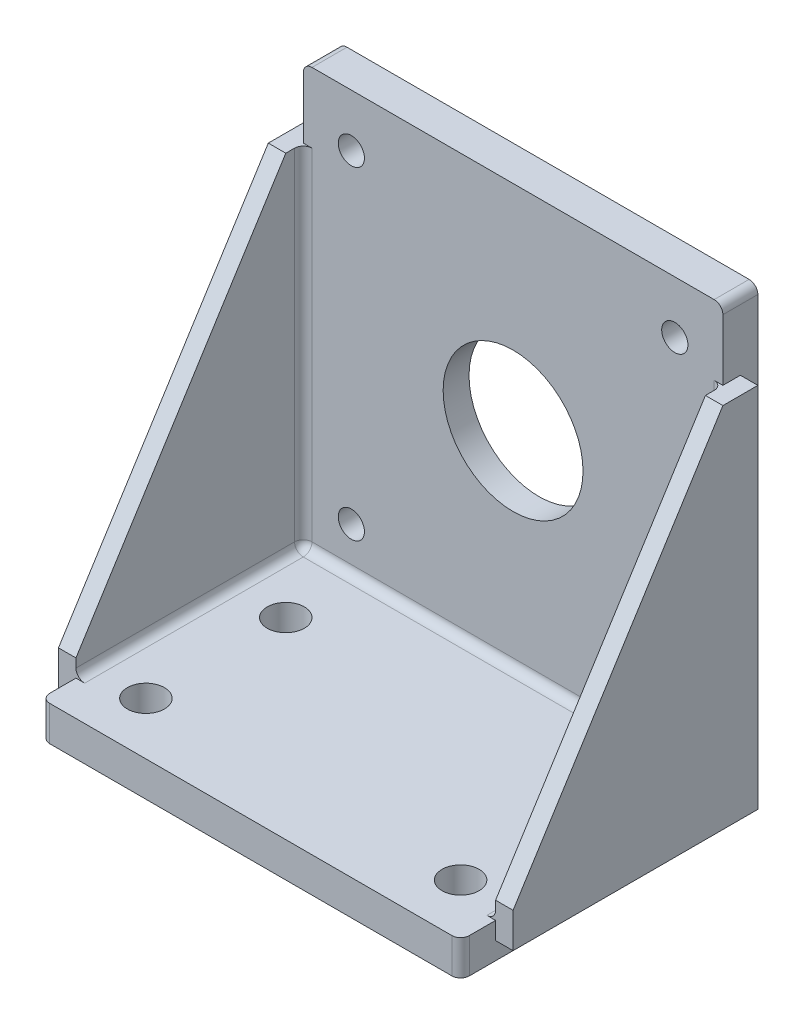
SolidWorks part; units mm, degrees
ref_plane "front" through (0, 0, 0) normal (0, 0, 1) x (1, 0, 0)
ref_plane "top" through (0, 0, 0) normal (0, 1, 0) x (1, 0, 0)
ref_plane "side" through (0, 0, 0) normal (1, 0, 0) x (0, 0, -1)
sketch "Sketch1" plane through (0, 0, 0) normal (0, 0, 1) x (1, 0, 0)
  line L0 (0, 0) -> (0, 77.7875) construction
  line L1 (-58.7375, 0) -> (0, 0) construction
  line L2 (76.2, -74.6125) -> (76.2, 77.7875)
  line L3 (76.2, 77.7875) -> (-76.2, 77.7875)
  line L4 (-76.2, 77.7875) -> (-76.2, -74.6125)
  line L5 (76.2, -74.6125) -> (-76.2, -74.6125)
  line L6 (-58.7375, 58.7375) -> (58.7375, 58.7375) construction
  line L7 (-58.7375, -58.7375) -> (58.7375, -58.7375) construction
  line L8 (-58.7375, -58.7375) -> (-58.7375, 58.7375) construction
  line L9 (58.7375, -58.7375) -> (58.7375, 58.7375) construction
  circle A4 centre (58.7375, 58.7375) radius 4.7625
  circle A6 centre (-58.7375, 58.7375) radius 4.7625
  circle A7 centre (58.7375, -58.7375) radius 4.7625
  circle A8 centre (-58.7375, -58.7375) radius 4.7625
  dimension "D1" = 117.475
  dimension "D3" = 9.525
  dimension "D2" = 152.4
  dimension "D4" = 117.475
  dimension "D5" = 19.05
  dimension "D6" = 152.4
extrude "Base-Extrude" add sketch "Sketch1" along normal blind 12.7
sketch "Sketch2" plane through (76.2, 0, 0) normal (1, 0, 0) x (0, 0, -1)
  line L0 (-6.35, -74.6125) -> (-107.95, -74.6125)
  line L1 (-6.35, -74.6125) -> (-6.35, -87.3125)
  line L2 (-107.95, -87.3125) -> (-6.35, -87.3125)
  line L3 (-107.95, -87.3125) -> (-107.95, -74.6125)
  line L4 (-12.7, -74.6125) -> (0, -74.6125) construction
  dimension "D1" = 101.6
  dimension "D2" = 12.7
extrude "Boss-Extrude1" add sketch "Sketch2" against normal up to vertex (152.4 mm away)
sketch "Sketch3" plane through (76.2, 0, 0) normal (1, 0, 0) x (0, 0, -1)
  line L0 (-6.35, -80.9625) -> (-6.35, 52.3875)
  line L1 (-6.35, 52.3875) -> (-19.05, 52.3875)
  line L2 (-19.05, 52.3875) -> (-95.25, -68.2625)
  line L3 (-95.25, -68.2625) -> (-95.25, -80.9625)
  line L4 (-6.35, -80.9625) -> (-95.25, -80.9625)
  line L5 (-6.35, -74.6125) -> (-6.35, -87.3125) construction
  line L6 (-12.7, 77.7875) -> (0, 77.7875) construction
  line L7 (-107.95, -87.3125) -> (-107.95, -74.6125) construction
  dimension "D1" = 12.7
  dimension "D2" = 12.7
  dimension "D3" = 25.4
  dimension "D4" = 12.7
extrude "Boss-Extrude2" add sketch "Sketch3" along normal blind 6.35
mirror "Mirror1" about plane through (0, 0, 0) normal (1, 0, 0) of "Boss-Extrude2"
sketch "Sketch4" plane through (0, -74.6125, 0) normal (0, 1, 0) x (-1, 0, 0)
  line L0 (76.2, 95.25) -> (76.2, 107.95) construction
  line L1 (76.2, 107.95) -> (-76.2, 107.95) construction
  circle A0 centre (57.15, 88.9) radius 6.7437
  dimension "D1" = 13.4874
  dimension "D2" = 19.05
  dimension "D3" = 19.05
extrude "Cut-Extrude1" cut sketch "Sketch4" against normal through all
pattern_linear "LPattern1" count 2 spacing 114.3 along (1, 0, 0) count 2 spacing 50.8 along (0, 0, -1) of "Cut-Extrude1"
sketch "Sketch5" plane through (0, 0, 0) normal (0, 0, -1) x (-1, 0, 0)
  circle A0 centre (0, 0) radius 63.5635
  dimension "D1" = 127.127
extrude "pilot bore" cut sketch "Sketch5" against normal blind 3.302
sketch "Sketch6" plane through (0, 0, 3.302) normal (0, 0, -1) x (-1, 0, 0)
  circle A0 centre (0, 0) radius 25.4
  dimension "D1" = 50.8
extrude "Cut-Extrude3" cut sketch "Sketch6" against normal through all
fillet "Fillet1" radius 3.175 4 edges
fillet "Fillet2" radius 3.175 11 edges at (-76.2, -73.6826, 13.6299) (76.2, -73.6826, 13.6299) (76.2, -80.9625, 107.95) (-76.2, -80.9625, 107.95) (76.2, 77.7875, 6.35) (-76.2, 77.7875, 6.35)
